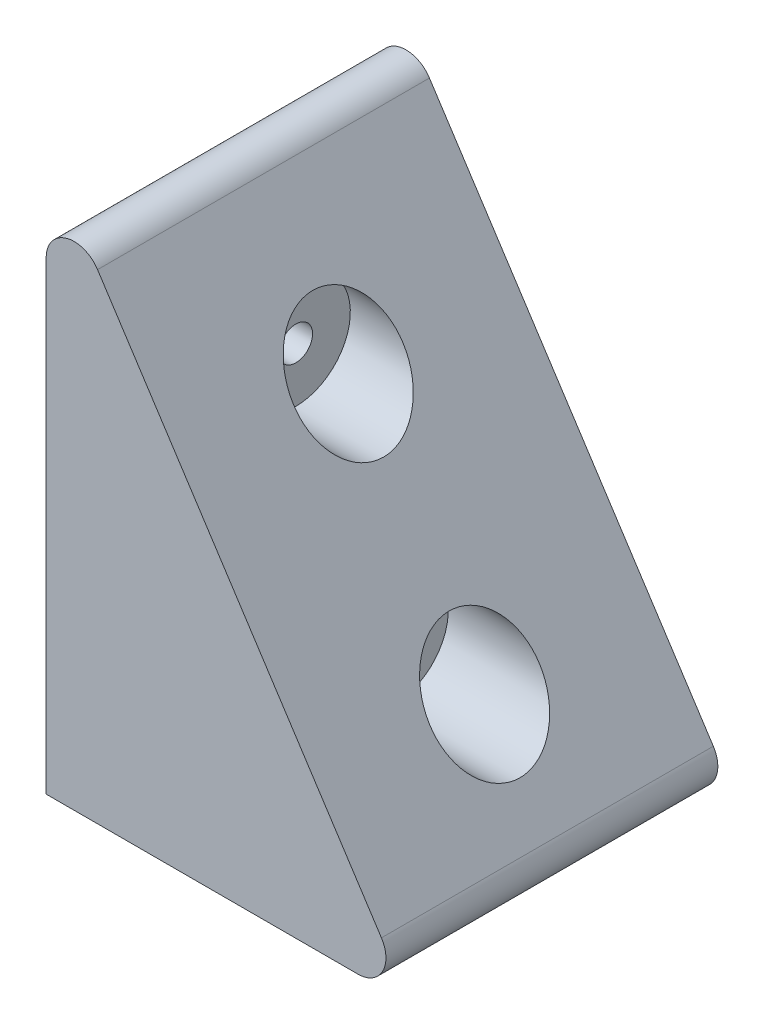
SolidWorks part; units mm, degrees
ref_plane "Front Plane" through (0, 0, 0) normal (0, 0, 1) x (1, 0, 0)
ref_plane "Top Plane" through (0, 0, 0) normal (0, 1, 0) x (1, 0, 0)
ref_plane "Right Plane" through (0, 0, 0) normal (1, 0, 0) x (0, 0, -1)
sketch "Sketch2" plane through (0, 0, 0) normal (0, 0, 1) x (1, 0, 0)
  line L0 (0, 0) -> (28.3396, 0)
  line L1 (0, 0) -> (0, 42.2317)
  line L2 (4.6696, 43.6159) -> (30.4692, 3.9243)
  arc A0 (28.3396, 0) -> (30.4692, 3.9243) centre (28.3396, 2.54) ccw
  arc A1 (0, 42.2317) -> (4.6696, 43.6159) centre (2.54, 42.2317) cw
  point P6 (33.02, 0)
  point P9 (0, 50.8)
  dimension "D3" = 2.54
  dimension "D1" = 50.8
  dimension "D2" = 33.02
extrude "Boss-Extrude1" add sketch "Sketch2" along normal blind 30.1625
ref_plane "Plane1" through (20.32, 0, 0) normal (-1, 0, 0) x (0, 0, 1)
sketch "Sketch3" plane through (20.32, 0, 0) normal (-1, 0, 0) x (0, 0, 1)
  line L0 (30.1625, 0) -> (0, 0) construction
  line L1 (30.1625, 3.9243) -> (30.1625, 43.6159) construction
  circle A0 centre (15.0812, 12.7) radius 4.953
  dimension "D2" = 9.906
  dimension "D1" = 12.7
  dimension "D4" = 15.0812
extrude "Cut-Extrude1" cut sketch "Sketch3" against normal blind 25.4 and the other way blind 3.81
sketch "Sketch4" plane through (16.51, 0, 0) normal (1, 0, 0) x (0, 0, -1)
  circle A0 centre (-15.0812, 12.7) radius 1.524
  dimension "D1" = 3.048
extrude "Cut-Extrude2" cut sketch "Sketch4" against normal blind 25.4
sketch "Sketch5" plane through (20.32, 0, 0) normal (-1, 0, 0) x (0, 0, 1)
  line L0 (30.1625, 42.2317) -> (30.1625, 0) construction
  line L1 (30.1625, 0) -> (0, 0) construction
  circle A0 centre (15.0932, 31.75) radius 4.953
  dimension "D1" = 9.906
  dimension "D2" = 15.0693
  dimension "D3" = 31.75
extrude "Cut-Extrude3" cut sketch "Sketch5" along normal blind 12.7
sketch "Sketch6" plane through (7.62, 0, 0) normal (1, 0, 0) x (0, 0, -1)
  circle A0 centre (-15.0932, 31.75) radius 1.524
  dimension "D1" = 3.048
extrude "Cut-Extrude4" cut sketch "Sketch6" against normal blind 12.7
